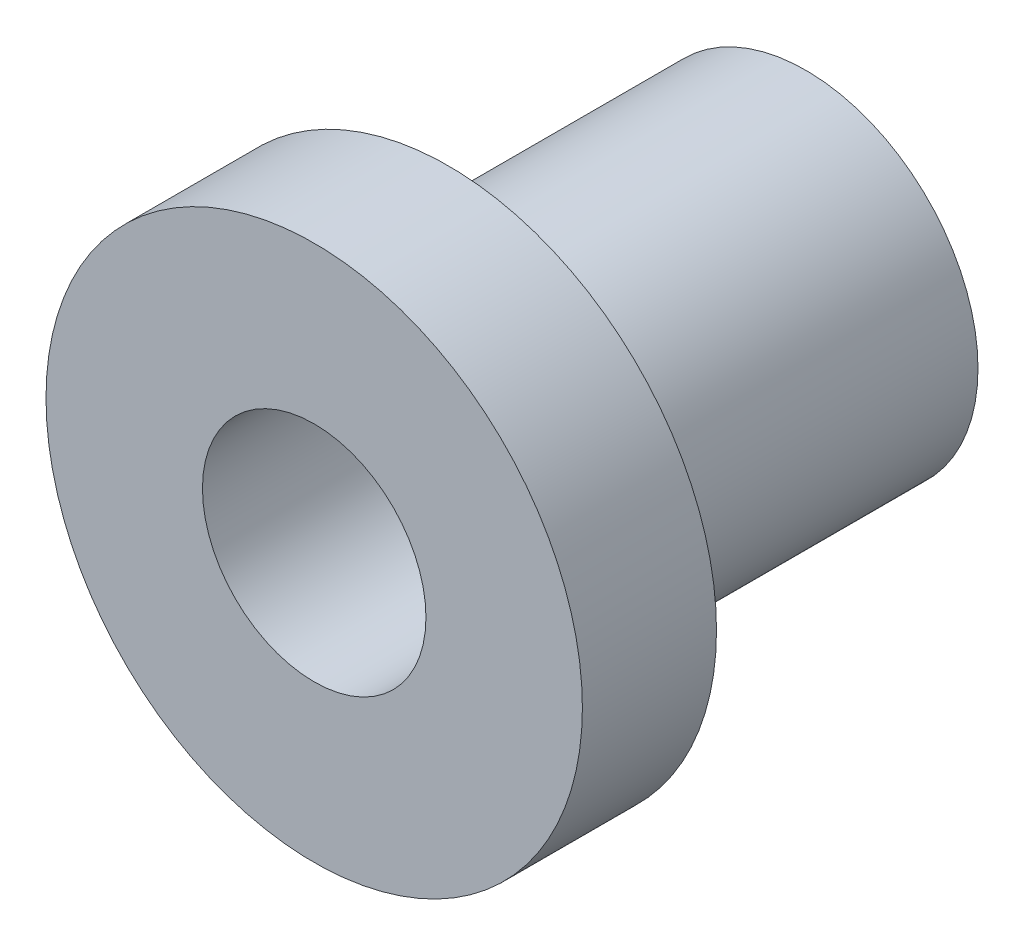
SolidWorks part; units mm, degrees
ref_plane "Plan de face" through (0, 0, 0) normal (0, 0, 1) x (1, 0, 0)
ref_plane "Plan de dessus" through (0, 0, 0) normal (0, 1, 0) x (1, 0, 0)
ref_plane "Plan de droite" through (0, 0, 0) normal (1, 0, 0) x (0, 0, -1)
sketch "Esquisse1" plane through (0, 0, 0) normal (0, 0, 1) x (1, 0, 0)
  circle A0 centre (0, 0) radius 3.85
  dimension "D1" = 7.7
extrude "Boss.-Extru.1" add sketch "Esquisse1" along normal blind 8
sketch "Esquisse2" plane through (0, 0, 8) normal (0, 0, 1) x (1, 0, 0)
  circle A0 centre (0, 0) radius 6
  dimension "D1" = 12
extrude "Boss.-Extru.2" add sketch "Esquisse2" along normal blind 3
sketch "Esquisse3" plane through (0, 0, 0) normal (0, 0, -1) x (-1, 0, 0)
  circle A0 centre (0, 0) radius 2.5
  dimension "D1" = 5
extrude "Enlèv. mat.-Extru.1" cut sketch "Esquisse3" against normal blind 12
